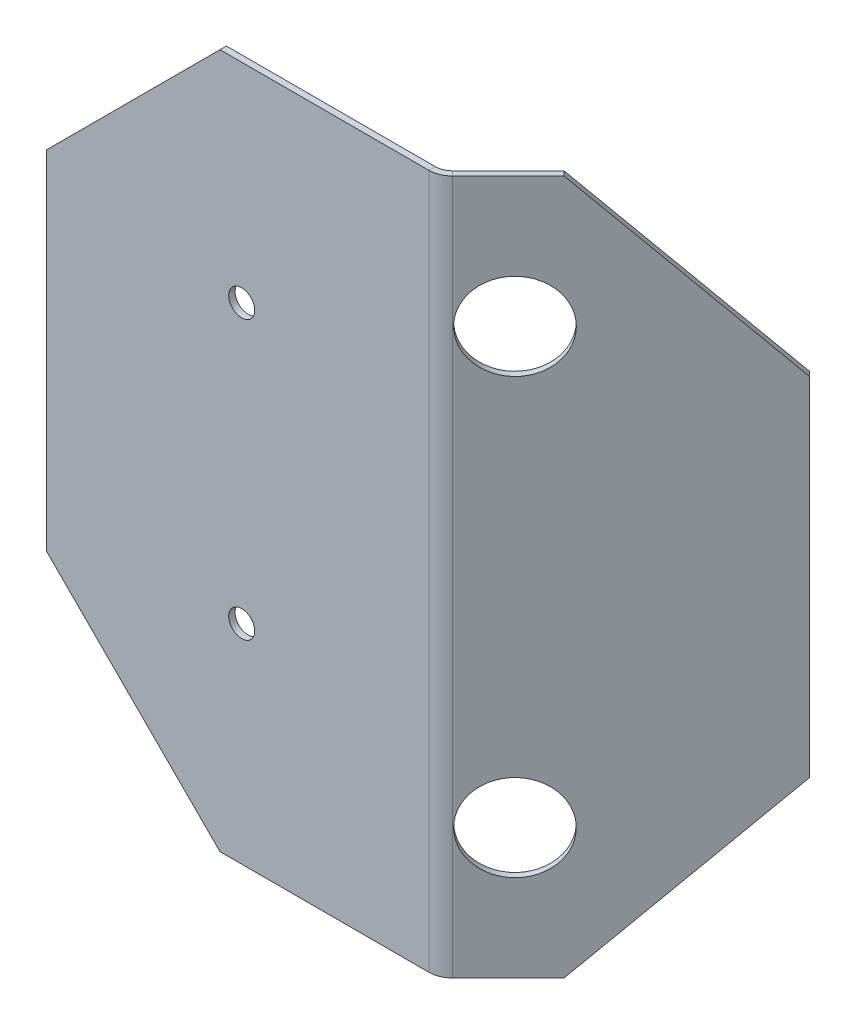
SolidWorks part; units mm, degrees
ref_plane "Face" through (0, 0, 0) normal (0, 0, 1) x (1, 0, 0)
ref_plane "Dessus" through (0, 0, 0) normal (0, 1, 0) x (1, 0, 0)
ref_plane "Droite" through (0, 0, 0) normal (1, 0, 0) x (0, 0, -1)
sketch "Esquisse1" plane through (0, 0, 0) normal (0, 0, 1) x (1, 0, 0)
  line L0 (-69.6398, 0) -> (51.4242, 0) construction
  line L1 (0, 45.1188) -> (0, -46.8002) construction
  line L2 (-45, 45.1188) -> (-45, -46.8002) construction
  line L3 (-49.4625, 40) -> (65.156, 40) construction
  line L4 (30, 45.1188) -> (30, -58.8506) construction
  line L5 (-25, 40) -> (-45, 40)
  line L6 (-25, 40) -> (30, 40)
  line L7 (30, 40) -> (30, -40)
  line L8 (-45, 40) -> (-45, -40)
  line L9 (-45, -40) -> (-25, -40)
  line L10 (-25, -40) -> (30, -40)
  line L11 (6, 36.3443) -> (6, 15.5761) construction
  line L12 (1.5572, 25) -> (14.1335, 25) construction
  line L13 (-6.5193, 16) -> (-35.0178, 16) construction
  line L14 (-45, 8.4227) -> (-45, -10.7302) construction
  line L15 (-22.5, 18.3452) -> (-22.5, 12.4609) construction
  line L16 (42.1227, -40) -> (-68.0295, -40) construction
  circle A0 centre (-22.5, 16) radius 1.5
  circle A1 centre (6, 25) radius 5
  circle A2 centre (-22.5, -16) radius 1.5
  circle A3 centre (6, -25) radius 5
  point P10 (-45, -40)
  point P11 (-45, 40)
  point P13 (-45, 0)
  point P19 (30, 0)
  dimension "D1" = 3
extrude "Base-Extrusion" add sketch "Esquisse1" along normal blind 0.7366
sketch "Esquisse2" plane through (0, 0, 0) normal (0, 0, -1) x (-1, 0, 0)
  line L0 (0, 42.2286) -> (0, -44.8824)
chamfer "Chanfrein1" distance 20 angle 45 4 edges at (-45, -40, 0.3683) (-45, 40, 0.3683) (30, 40, 0.3683) (30, -40, 0.3683)
sketch "Esquisse3" plane through (0, 0, 0.7366) normal (0, 0, 1) x (1, 0, 0)
  line L0 (0, 40) -> (0, -40) construction
sheet metal parameters "Tôlerie 7" parameters "D1"=2
flatten bends "Dépliage 6" parameters "D1"=0
sketch "Esquisse-Angle6" plane through (0, 0, 0) normal (0, 0, -1) x (-1, 0, 0)
process bends "Pliage 6" parameters "D1"=0
sketch "Esquisse-Plate6" plane through (0, 0, 0) normal (0, 0, -1) x (-1, 0, 0)
sketched bend "Pli esquissé5" parameters "D1"=0
bend "Pli d'esquisse5" bend radius 2 bend angle 45 parameters "D5"=1
flat pattern "Etat déplié5"
sketch "Lignes de pliage5" plane through (0, 0, 0) normal (0, 0, -1) x (-1, 0, 0)
  line L0 (0, 40) -> (0, -40) construction
bend of the flat pattern "Flatten-<Pli d'esquisse5>1" parameters "D3"=15
